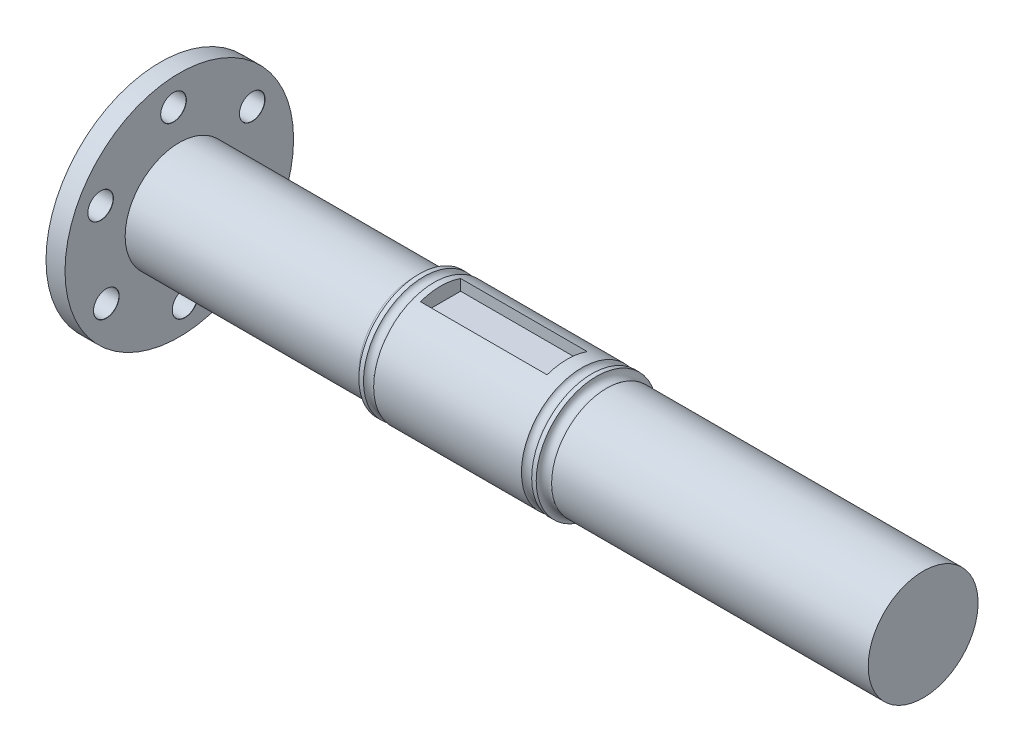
SolidWorks part; units mm, degrees
ref_plane "Front Plane" through (0, 0, 0) normal (0, 0, 1) x (1, 0, 0)
ref_plane "Top Plane" through (0, 0, 0) normal (0, 1, 0) x (1, 0, 0)
ref_plane "Right Plane" through (0, 0, 0) normal (1, 0, 0) x (0, 0, -1)
sketch "Sketch2" plane through (0, 0, 0) normal (0, 0, 1) x (1, 0, 0)
  line L0 (15.2232, -1.039) -> (19.7232, -1.039)
  line L1 (19.7232, -1.039) -> (19.7232, -8.589)
  line L2 (19.7232, -8.589) -> (22.7232, -8.589)
  line L3 (22.7232, -8.589) -> (22.7232, 0.911)
  line L4 (22.7232, 0.911) -> (59.6532, 0.911)
  line L5 (15.2232, 9.461) -> (140.1914, 9.461) construction
  line L6 (60.6213, -0.0792) -> (61.3448, -0.0792)
  line L8 (87.9013, -0.0741) -> (88.6213, -0.0752)
  line L9 (90.1914, 0.7854) -> (140.1914, 0.7854)
  line L10 (15.2232, -1.039) -> (15.2232, 9.461)
  line L11 (140.1914, 0.7854) -> (140.1914, 9.461)
  line L22 (62.9546, -0.0792) -> (86.2913, -0.0792)
  arc A0 (88.6213, -0.0752) -> (90.1914, 0.7854) centre (89.6205, -0.0356) cw
  arc A1 (61.3448, -0.0792) -> (62.9546, -0.0792) centre (62.1497, -0.4663) cw
  arc A2 (86.2913, -0.0792) -> (87.9013, -0.0741) centre (87.0975, -0.4622) cw
  arc A3 (60.6213, -0.0792) -> (59.6532, 0.911) centre (59.6213, -0.0885) ccw
  dimension "D10" = 36.93
  dimension "D4" = 1
  dimension "D7" = 1
  dimension "D14" = 0.8932
  dimension "D1" = 4.5
  dimension "D2" = 3
  dimension "D3" = 9.5
  dimension "D5" = 28
  dimension "D6" = 10.5
  dimension "D8" = 50
  dimension "D9" = 7.55
  dimension "D11" = 0.7235
  dimension "D12" = 0.72
  dimension "D15" = 1.61
revolve "Revolve2" add sketch "Sketch2" angle 360 about L5
sketch "Sketch5" plane through (22.7232, 0, 0) normal (1, 0, 0) x (0, 0, -1)
  circle A2 centre (-0.9093, 23.286) radius 3.5
  circle A3 centre (11.5181, 17.161) radius 3.5
  circle A4 centre (12.4275, 3.336) radius 3.5
  circle A5 centre (0.9093, -4.364) radius 3.5
  circle A6 centre (-11.5181, 1.761) radius 3.5
  circle A7 centre (-12.4275, 15.586) radius 3.5
  circle A8 centre (0, 9.461) radius 18.05 construction
  point P3 (11.5181, 17.161)
  point P5 (12.4275, 3.336)
  point P7 (-0.9093, 23.286)
  point P10 (0.9093, -4.364)
  point P12 (-11.5181, 1.761)
  point P14 (-12.4275, 15.586)
  point P16 (0, 9.461)
  dimension "D1" = 7
  dimension "D2" = 6
hole_wizard "Ø4.0mm Dowel Hole1" positions "Sketch5" profile "Sketch6" hole size "Ø4.0" standard "ANSI Metric"
sketch "Sketch6" plane through (22.7232, 17.161, -11.5181) normal (0, 1, 0) x (0, 0, -1)
  line L0 (0, 0) -> (0, 7.5)
  line L1 (0, 7.5) -> (2, 7.5)
  line L2 (2, 7.5) -> (2, 0.025)
  line L3 (2, 0.025) -> (2.025, 0)
  line L5 (2.025, 0) -> (0, 0)
  line L6 (-2, 0.025) -> (-2.025, 0) construction
  line L11 (0, -6.35) -> (0, 107.95) construction
  dimension "Thru Hole Dia." = 4
  dimension "Thru Hole Depth" = 7.5
  dimension "Near C'Sink Dia." = 4.05
  dimension "Near C'Sink Angle" = 90
ref_plane "Plane1" through (73.9732, 0, 0) normal (1, 0, 0) x (0, 0, -1)
sketch "Sketch8" plane through (73.9732, 0, 0) normal (1, 0, 0) x (0, 0, -1)
  line L0 (0, 16.3022) -> (0, 0) construction
  line L1 (-3.175, 16.715) -> (3.175, 16.715)
  line L2 (3.175, 16.715) -> (3.175, 19.077)
  line L3 (-3.175, 16.715) -> (-3.175, 19.077)
  line L4 (-3.175, 19.077) -> (3.175, 19.077)
  dimension "D2" = 2.362
  dimension "D3" = 6.35
extrude "Cut-Extrude1" cut sketch "Sketch8" against normal blind 10 and the other way blind 10
